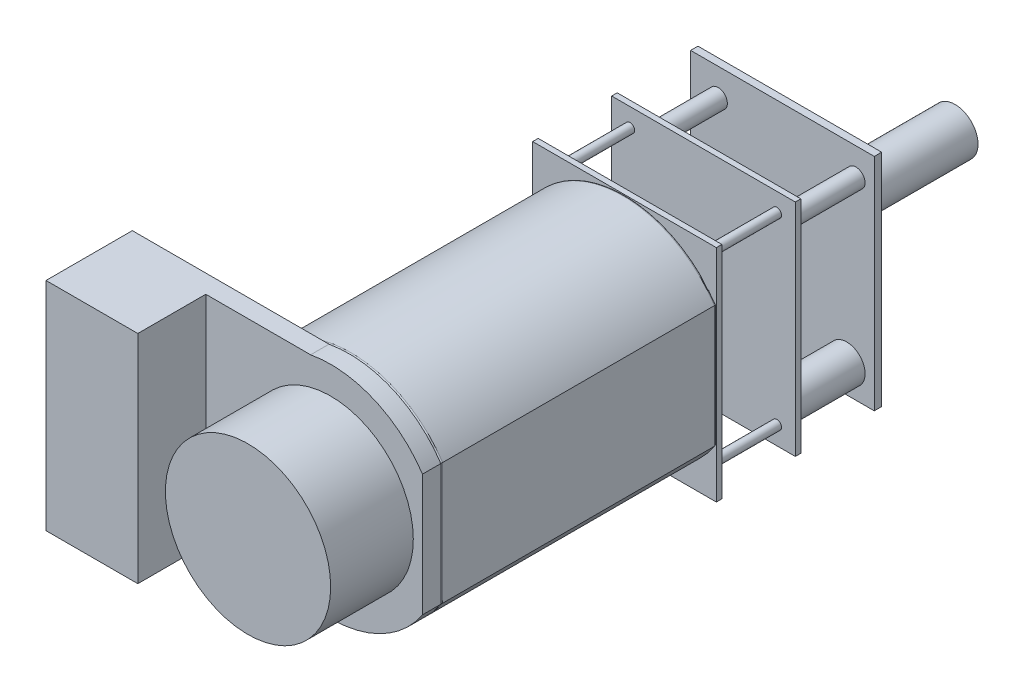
SolidWorks part; units mm, degrees
ref_plane "Front Plane" through (0, 0, 0) normal (0, 0, 1) x (1, 0, 0)
ref_plane "Top Plane" through (0, 0, 0) normal (0, 1, 0) x (1, 0, 0)
ref_plane "Right Plane" through (0, 0, 0) normal (1, 0, 0) x (0, 0, -1)
sketch "Sketch1" plane through (0, 0, 0) normal (0, 0, 1) x (1, 0, 0)
  line L2 (-5, -3.3166) -> (-5, 3.3166)
  line L4 (5, -3.3166) -> (5, 3.3166)
  line L5 (-3.8411, -4.6093) -> (3.8411, 4.6093) construction
  line L6 (-3.8411, 4.6093) -> (3.8411, -4.6093) construction
  arc A0 (-5, -3.3166) -> (5, -3.3166) centre (0, 0) ccw
  arc A1 (5, 3.3166) -> (-5, 3.3166) centre (0, 0) ccw
  point P0 (0, 0)
  dimension "D3" = 12
  dimension "D1" = 5
  dimension "D2" = 3.8411
extrude "Boss-Extrude1" add sketch "Sketch1" along normal blind 15
fillet "Fillet1" radius 0.1 8 edges at (0, -6, 15) (-5, 0, 15) (0, 6, 15) (5, 0, 15) (0, -6, 0) (5, 0, 0) (-5, 0, 0) (0, 6, 0)
sketch "Sketch2" plane through (0, 0, 15) normal (0, 0, 1) x (1, 0, 0)
  circle A0 centre (0, 0) radius 2.5
  dimension "D1" = 5
extrude "Boss-Extrude2" add sketch "Sketch2" along normal blind 1
sketch "Sketch3" plane through (0, 0, 16) normal (0, 0, 1) x (1, 0, 0)
  circle A0 centre (0, 0) radius 1.25
  dimension "D1" = 2.5
extrude "Boss-Extrude3" add sketch "Sketch3" along normal blind 0.1
sketch "Sketch4" plane through (0, 0, 0) normal (0, 0, -1) x (-1, 0, 0)
  line L1 (-5, -6) -> (5, -6)
  line L2 (-5, -6) -> (-5, 6)
  line L3 (-5, 6) -> (5, 6)
  line L4 (5, -6) -> (5, 6)
  line L5 (-5, -6) -> (5, 6) construction
  line L6 (-5, 6) -> (5, -6) construction
  point P0 (0, 0)
  dimension "D1" = 12
  dimension "D2" = 10
extrude "Boss-Extrude4" add sketch "Sketch4" along normal blind 0.3
sketch "Sketch5" plane through (0, 0, -0.3) normal (0, 0, -1) x (-1, 0, 0)
  circle A0 centre (0, 0) radius 0.5
  dimension "D1" = 1
extrude "Boss-Extrude5" add sketch "Sketch5" along normal blind 1
sketch "Sketch6" plane through (0, 0, -0.3) normal (0, 0, -1) x (-1, 0, 0)
  line L0 (-0.1, 1.4967) -> (0, 1.6699)
  line L1 (0, 1.6699) -> (0.1, 1.4967)
  line L2 (0.1688, 1.4905) -> (0.2982, 1.643)
  line L3 (0.2982, 1.643) -> (0.3656, 1.4548)
  line L4 (0.4323, 1.4364) -> (0.5867, 1.5634)
  line L5 (0.5867, 1.5634) -> (0.6195, 1.3661)
  line L6 (0.6818, 1.3361) -> (0.8565, 1.4335)
  line L7 (0.8565, 1.4335) -> (0.8535, 1.2335)
  line L8 (0.9094, 1.1929) -> (1.0987, 1.2575)
  line L9 (1.0987, 1.2575) -> (1.06, 1.0613)
  line L10 (1.1078, 1.0113) -> (1.3056, 1.0411)
  line L11 (1.3056, 1.0411) -> (1.2325, 0.855)
  line L12 (1.2706, 0.7973) -> (1.4705, 0.7913)
  line L13 (1.4705, 0.7913) -> (1.3653, 0.6212)
  line L14 (1.3925, 0.5576) -> (1.5881, 0.516)
  line L15 (1.5881, 0.516) -> (1.4543, 0.3674)
  line L16 (1.4697, 0.3) -> (1.6548, 0.2242)
  line L17 (1.6548, 0.2242) -> (1.4965, 0.1018)
  line L18 (1.4996, 0.0328) -> (1.6682, -0.0749)
  line L19 (1.6682, -0.0749) -> (1.4907, -0.167)
  line L20 (1.4814, -0.2355) -> (1.628, -0.3716)
  line L21 (1.628, -0.3716) -> (1.4369, -0.4305)
  line L22 (1.4155, -0.4963) -> (1.5355, -0.6563)
  line L23 (1.5355, -0.6563) -> (1.3369, -0.6802)
  line L24 (1.3042, -0.741) -> (1.3936, -0.9199)
  line L25 (1.3936, -0.9199) -> (1.194, -0.908)
  line L26 (1.1509, -0.962) -> (1.207, -1.154)
  line L27 (1.207, -1.154) -> (1.0127, -1.1066)
  line L28 (0.9606, -1.152) -> (0.9815, -1.351)
  line L29 (0.9815, -1.351) -> (0.7988, -1.2696)
  line L30 (0.7395, -1.3051) -> (0.7245, -1.5045)
  line L31 (0.7245, -1.5045) -> (0.5593, -1.3918)
  line L32 (0.4946, -1.4161) -> (0.4442, -1.6097)
  line L33 (0.4442, -1.6097) -> (0.3018, -1.4693)
  line L34 (0.2338, -1.4817) -> (0.1497, -1.6631)
  line L35 (0.1497, -1.6631) -> (0.0346, -1.4996)
  line L36 (-0.0346, -1.4996) -> (-0.1497, -1.6631)
  line L37 (-0.1497, -1.6631) -> (-0.2338, -1.4817)
  line L38 (-0.3018, -1.4693) -> (-0.4442, -1.6097)
  line L39 (-0.4442, -1.6097) -> (-0.4946, -1.4161)
  line L40 (-0.5593, -1.3918) -> (-0.7245, -1.5045)
  line L41 (-0.7245, -1.5045) -> (-0.7395, -1.3051)
  line L42 (-0.7988, -1.2696) -> (-0.9815, -1.351)
  line L43 (-0.9815, -1.351) -> (-0.9606, -1.152)
  line L44 (-1.0127, -1.1066) -> (-1.207, -1.154)
  line L45 (-1.207, -1.154) -> (-1.1509, -0.962)
  line L46 (-1.194, -0.908) -> (-1.3936, -0.9199)
  line L47 (-1.3936, -0.9199) -> (-1.3042, -0.741)
  line L48 (-1.3369, -0.6802) -> (-1.5355, -0.6563)
  line L49 (-1.5355, -0.6563) -> (-1.4155, -0.4963)
  line L50 (-1.4369, -0.4305) -> (-1.628, -0.3716)
  line L51 (-1.628, -0.3716) -> (-1.4814, -0.2355)
  line L52 (-1.4907, -0.167) -> (-1.6682, -0.0749)
  line L53 (-1.6682, -0.0749) -> (-1.4996, 0.0328)
  line L54 (-1.4965, 0.1018) -> (-1.6548, 0.2242)
  line L55 (-1.6548, 0.2242) -> (-1.4697, 0.3)
  line L56 (-1.4543, 0.3674) -> (-1.5881, 0.516)
  line L57 (-1.5881, 0.516) -> (-1.3925, 0.5576)
  line L58 (-1.3653, 0.6212) -> (-1.4705, 0.7913)
  line L59 (-1.4705, 0.7913) -> (-1.2706, 0.7973)
  line L60 (-1.2325, 0.855) -> (-1.3056, 1.0411)
  line L61 (-1.3056, 1.0411) -> (-1.1078, 1.0113)
  line L62 (-1.06, 1.0613) -> (-1.0987, 1.2575)
  line L63 (-1.0987, 1.2575) -> (-0.9094, 1.1929)
  line L64 (-0.8535, 1.2335) -> (-0.8565, 1.4335)
  line L65 (-0.8565, 1.4335) -> (-0.6818, 1.3361)
  line L66 (-0.6195, 1.3661) -> (-0.5867, 1.5634)
  line L67 (-0.5867, 1.5634) -> (-0.4323, 1.4364)
  line L68 (-0.3656, 1.4548) -> (-0.2982, 1.643)
  line L69 (-0.2982, 1.643) -> (-0.1688, 1.4905)
  circle A0 centre (0, 0) radius 0.5
  arc A1 (-1.06, 1.0613) -> (-1.1078, 1.0113) centre (0, 0) ccw
  arc A2 (-0.8535, 1.2335) -> (-0.9094, 1.1929) centre (0, 0) ccw
  arc A3 (-0.6195, 1.3661) -> (-0.6818, 1.3361) centre (0, 0) ccw
  arc A4 (-0.3656, 1.4548) -> (-0.4323, 1.4364) centre (0, 0) ccw
  arc A5 (-0.1, 1.4967) -> (-0.1688, 1.4905) centre (0, 0) ccw
  arc A6 (0.1688, 1.4905) -> (0.1, 1.4967) centre (0, 0) ccw
  arc A7 (0.4323, 1.4364) -> (0.3656, 1.4548) centre (0, 0) ccw
  arc A8 (0.6818, 1.3361) -> (0.6195, 1.3661) centre (0, 0) ccw
  arc A9 (0.9094, 1.1929) -> (0.8535, 1.2335) centre (0, 0) ccw
  arc A10 (1.1078, 1.0113) -> (1.06, 1.0613) centre (0, 0) ccw
  arc A11 (1.2706, 0.7973) -> (1.2325, 0.855) centre (0, 0) ccw
  arc A12 (1.3925, 0.5576) -> (1.3653, 0.6212) centre (0, 0) ccw
  arc A13 (1.4697, 0.3) -> (1.4543, 0.3674) centre (0, 0) ccw
  arc A14 (1.4996, 0.0328) -> (1.4965, 0.1018) centre (0, 0) ccw
  arc A15 (1.4814, -0.2355) -> (1.4907, -0.167) centre (0, 0) ccw
  arc A16 (1.4155, -0.4963) -> (1.4369, -0.4305) centre (0, 0) ccw
  arc A17 (1.3042, -0.741) -> (1.3369, -0.6802) centre (0, 0) ccw
  arc A18 (1.1509, -0.962) -> (1.194, -0.908) centre (0, 0) ccw
  arc A19 (0.9606, -1.152) -> (1.0127, -1.1066) centre (0, 0) ccw
  arc A20 (0.7395, -1.3051) -> (0.7988, -1.2696) centre (0, 0) ccw
  arc A21 (0.4946, -1.4161) -> (0.5593, -1.3918) centre (0, 0) ccw
  arc A22 (0.2338, -1.4817) -> (0.3018, -1.4693) centre (0, 0) ccw
  arc A23 (-0.0346, -1.4996) -> (0.0346, -1.4996) centre (0, 0) ccw
  arc A24 (-0.3018, -1.4693) -> (-0.2338, -1.4817) centre (0, 0) ccw
  arc A25 (-0.5593, -1.3918) -> (-0.4946, -1.4161) centre (0, 0) ccw
  arc A26 (-0.7988, -1.2696) -> (-0.7395, -1.3051) centre (0, 0) ccw
  arc A27 (-1.0127, -1.1066) -> (-0.9606, -1.152) centre (0, 0) ccw
  arc A28 (-1.194, -0.908) -> (-1.1509, -0.962) centre (0, 0) ccw
  arc A29 (-1.3369, -0.6802) -> (-1.3042, -0.741) centre (0, 0) ccw
  arc A30 (-1.4369, -0.4305) -> (-1.4155, -0.4963) centre (0, 0) ccw
  arc A31 (-1.4907, -0.167) -> (-1.4814, -0.2355) centre (0, 0) ccw
  arc A32 (-1.4965, 0.1018) -> (-1.4996, 0.0328) centre (0, 0) ccw
  arc A33 (-1.4543, 0.3674) -> (-1.4697, 0.3) centre (0, 0) ccw
  arc A34 (-1.3653, 0.6212) -> (-1.3925, 0.5576) centre (0, 0) ccw
  arc A35 (-1.2325, 0.855) -> (-1.2706, 0.7973) centre (0, 0) ccw
  point P112 (0, 0)
  dimension "D1" = 1
  dimension "D2" = 3
  dimension "D3" = 0.2
  dimension "D4" = 0.2
  dimension "D5" = 60
  dimension "D6" = 35
extrude "Boss-Extrude6" add sketch "Sketch6" along normal blind 0.5
sketch "Sketch8" plane through (0, 0, -0.3) normal (0, 0, -1) x (-1, 0, 0)
  line L0 (5, -6) -> (5, 6) construction
  line L1 (-5, -6) -> (5, -6) construction
  line L2 (-5, 6) -> (-5, -6) construction
  circle A0 centre (-4, 5) radius 0.25
  circle A1 centre (4, 5) radius 0.25
  circle A2 centre (4, -5) radius 0.25
  circle A3 centre (-4, -5) radius 0.25
  dimension "D4" = 0.5
  dimension "D1" = 10
  dimension "D2" = 1
  dimension "D3" = 1
  dimension "D5" = 1
extrude "Boss-Extrude7" add sketch "Sketch8" along normal blind 4
sketch "Sketch9" plane through (0, 0, -4.3) normal (0, 0, -1) x (-1, 0, 0)
  line L1 (-5, -6) -> (5, -6)
  line L2 (-5, -6) -> (-5, 6)
  line L3 (-5, 6) -> (5, 6)
  line L4 (5, -6) -> (5, 6)
  line L5 (-5, -6) -> (5, 6) construction
  line L6 (-5, 6) -> (5, -6) construction
  point P0 (0, 0)
extrude "Boss-Extrude8" add sketch "Sketch9" along normal blind 0.3
sketch "Sketch10" plane through (0, 0, -4.6) normal (0, 0, -1) x (-1, 0, 0)
  line L0 (5, 6) -> (-5, 6) construction
  line L1 (-5, 6) -> (-5, -6) construction
  line L2 (-5, -6) -> (5, -6) construction
  line L3 (5, -6) -> (5, 6) construction
  circle A0 centre (-4, 4.5) radius 0.5
  circle A1 centre (-3.5, -4.5) radius 1
  circle A2 centre (3.5, 4.5) radius 0.5
  dimension "D5" = 2
  dimension "D6" = 1
  dimension "D7" = 1
  dimension "D8" = 1.5
  dimension "D1" = 1.5
  dimension "D2" = 1
  dimension "D3" = 1.5
  dimension "D4" = 1.5
extrude "Boss-Extrude9" add sketch "Sketch10" along normal blind 4
sketch "Sketch11" plane through (0, 0, -8.6) normal (0, 0, -1) x (-1, 0, 0)
  line L1 (-5, -6) -> (5, -6)
  line L2 (-5, -6) -> (-5, 6)
  line L3 (-5, 6) -> (5, 6)
  line L4 (5, -6) -> (5, 6)
  line L5 (-5, -6) -> (5, 6) construction
  line L6 (-5, 6) -> (5, -6) construction
  point P0 (0, 0)
extrude "Boss-Extrude10" add sketch "Sketch11" along normal blind 0.4
sketch "Sketch14" plane through (0, 0, -9) normal (0, 0, -1) x (-1, 0, 0)
  circle A0 centre (0, 0) radius 1.25
  dimension "D1" = 2.5
extrude "Boss-Extrude11" add sketch "Sketch14" along normal blind 9
sketch "Sketch15" plane through (0, 0, -9) normal (0, 0, -1) x (-1, 0, 0)
  circle A0 centre (0, 0) radius 1.5
  dimension "D1" = 3
extrude "Boss-Extrude12" add sketch "Sketch15" along normal blind 0.8
sketch "Sketch16" plane through (0, 0, 15) normal (0, 0, 1) x (1, 0, 0)
  line L0 (-4.9, 3.2863) -> (-4.9, -3.2863) construction
  line L4 (5, -3.3166) -> (5, 3.3166)
  line L5 (-3.8411, -4.6093) -> (3.8411, 4.6093) construction
  line L6 (-3.8411, 4.6093) -> (3.8411, -4.6093) construction
  line L8 (-1.0909, -5.9) -> (-11.8, -5.9)
  line L10 (-1.0909, 5.9) -> (-11.8, 5.9)
  line L11 (-11.8, -5.9) -> (-11.8, 5.9)
  arc A0 (-1.0909, -5.9) -> (5, -3.3166) centre (0, 0) ccw
  arc A1 (5, 3.3166) -> (-1.0909, 5.9) centre (0, 0) ccw
  point P0 (0, 0)
  dimension "D1" = 12
  dimension "D2" = 1.0589
  dimension "D3" = 9.9
  dimension "D4" = 6.8
  dimension "D5" = 11.8
  dimension "D6" = 1.0909
extrude "Boss-Extrude13" add sketch "Sketch16" along normal blind 1
sketch "Sketch17" plane through (0, 0, 16) normal (0, 0, 1) x (1, 0, 0)
  circle A0 centre (0, 0) radius 4.5
  dimension "D1" = 9
extrude "Boss-Extrude14" add sketch "Sketch17" along normal blind 4.5
sketch "Sketch18" plane through (0, 0, 16) normal (0, 0, 1) x (1, 0, 0)
  line L0 (-11.8, -5.9) -> (-1.0909, -5.9) construction
  line L1 (-11.8, 5.9) -> (-6.8, 5.9)
  line L2 (-11.8, 5.9) -> (-11.8, -5.9)
  line L3 (-11.8, -5.9) -> (-6.8, -5.9)
  line L4 (-6.8, 5.9) -> (-6.8, -5.9)
  dimension "D1" = 5
extrude "Boss-Extrude15" add sketch "Sketch18" along normal blind 3.7
sketch "Sketch19" plane through (-11.8, 0, 0) normal (-1, 0, 0) x (0, 0, 1)
  line L0 (19.7, 5.9) -> (15, 5.9) construction
  line L1 (19.6, 5.8) -> (15.5, 5.8)
  line L2 (19.6, 5.8) -> (19.6, -5.8)
  line L3 (19.6, -5.8) -> (15.5, -5.8)
  line L4 (15.5, 5.8) -> (15.5, -5.8)
  line L5 (19.7, -5.9) -> (15, -5.9) construction
  line L6 (19.7, 5.9) -> (19.7, -5.9) construction
  line L7 (15, 5.9) -> (15, -5.9) construction
  dimension "D1" = 0.1
  dimension "D2" = 0.1
  dimension "D3" = 0.1
  dimension "D4" = 0.5
extrude "Cut-Extrude1" cut sketch "Sketch19" against normal blind 3.2
scale "Escala1" scale about origin uniform scaling yes scale factor 1.5
